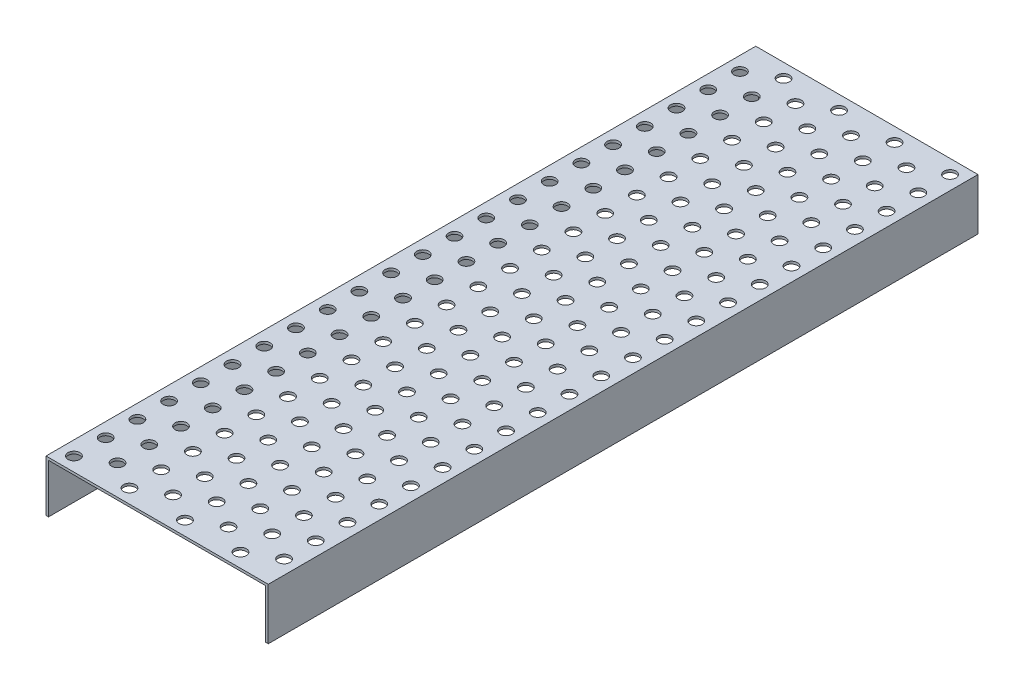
SolidWorks part; units mm, degrees
ref_plane "Alzado" through (0, 0, 0) normal (0, 0, 1) x (1, 0, 0)
ref_plane "Planta" through (0, 0, 0) normal (0, 1, 0) x (1, 0, 0)
ref_plane "Vista lateral" through (0, 0, 0) normal (1, 0, 0) x (0, 0, -1)
sketch "Croquis2" plane through (0, 0, 0) normal (0, 0, 1) x (1, 0, 0)
  line L0 (0, 0) -> (0, 41.275)
  line L1 (0, 41.275) -> (178, 41.275)
  line L2 (0, 0) -> (2, 0)
  line L3 (2, 0) -> (2, 39.275)
  line L4 (178, 41.275) -> (178, 0)
  line L5 (178, 0) -> (176, 0)
  line L6 (176, 0) -> (176, 39.275)
  line L7 (2, 39.275) -> (176, 39.275)
  dimension "D1" = 41.275
  dimension "D2" = 178
  dimension "D3" = 2
  dimension "D4" = 2
  dimension "D5" = 39.275
  dimension "D6" = 39.275
extrude "Saliente-Extruir1" add sketch "Croquis2" along normal blind 568.452
sketch "Croquis3" plane through (0, 41.275, 0) normal (0, 1, 0) x (1, 0, 0)
  circle A0 centre (11.2125, -23.876) radius 4.7625
  circle A1 centre (33.4375, -11.176) radius 4.7625
  circle A2 centre (55.6625, -23.876) radius 4.7625
  circle A3 centre (100.1125, -23.876) radius 4.7625
  circle A4 centre (144.5625, -23.876) radius 4.7625
  circle A5 centre (11.2125, -49.276) radius 4.7625
  circle A6 centre (55.6625, -49.276) radius 4.7625
  circle A7 centre (100.1125, -49.276) radius 4.7625
  circle A8 centre (144.5625, -49.276) radius 4.7625
  circle A9 centre (11.2125, -74.676) radius 4.7625
  circle A10 centre (55.6625, -74.676) radius 4.7625
  circle A11 centre (100.1125, -74.676) radius 4.7625
  circle A12 centre (144.5625, -74.676) radius 4.7625
  circle A13 centre (11.2125, -100.076) radius 4.7625
  circle A14 centre (55.6625, -100.076) radius 4.7625
  circle A15 centre (100.1125, -100.076) radius 4.7625
  circle A16 centre (144.5625, -100.076) radius 4.7625
  circle A17 centre (11.2125, -125.476) radius 4.7625
  circle A18 centre (55.6625, -125.476) radius 4.7625
  circle A19 centre (100.1125, -125.476) radius 4.7625
  circle A20 centre (144.5625, -125.476) radius 4.7625
  circle A21 centre (11.2125, -150.876) radius 4.7625
  circle A22 centre (55.6625, -150.876) radius 4.7625
  circle A23 centre (100.1125, -150.876) radius 4.7625
  circle A24 centre (144.5625, -150.876) radius 4.7625
  circle A25 centre (11.2125, -176.276) radius 4.7625
  circle A26 centre (55.6625, -176.276) radius 4.7625
  circle A27 centre (100.1125, -176.276) radius 4.7625
  circle A28 centre (144.5625, -176.276) radius 4.7625
  circle A29 centre (11.2125, -201.676) radius 4.7625
  circle A30 centre (55.6625, -201.676) radius 4.7625
  circle A31 centre (100.1125, -201.676) radius 4.7625
  circle A32 centre (144.5625, -201.676) radius 4.7625
  circle A33 centre (11.2125, -227.076) radius 4.7625
  circle A34 centre (55.6625, -227.076) radius 4.7625
  circle A35 centre (100.1125, -227.076) radius 4.7625
  circle A36 centre (144.5625, -227.076) radius 4.7625
  circle A37 centre (11.2125, -252.476) radius 4.7625
  circle A38 centre (55.6625, -252.476) radius 4.7625
  circle A39 centre (100.1125, -252.476) radius 4.7625
  circle A40 centre (144.5625, -252.476) radius 4.7625
  circle A41 centre (11.2125, -277.876) radius 4.7625
  circle A42 centre (55.6625, -277.876) radius 4.7625
  circle A43 centre (100.1125, -277.876) radius 4.7625
  circle A44 centre (144.5625, -277.876) radius 4.7625
  circle A45 centre (11.2125, -303.276) radius 4.7625
  circle A46 centre (55.6625, -303.276) radius 4.7625
  circle A47 centre (100.1125, -303.276) radius 4.7625
  circle A48 centre (144.5625, -303.276) radius 4.7625
  circle A49 centre (11.2125, -328.676) radius 4.7625
  circle A50 centre (55.6625, -328.676) radius 4.7625
  circle A51 centre (100.1125, -328.676) radius 4.7625
  circle A52 centre (144.5625, -328.676) radius 4.7625
  circle A53 centre (11.2125, -354.076) radius 4.7625
  circle A54 centre (55.6625, -354.076) radius 4.7625
  circle A55 centre (100.1125, -354.076) radius 4.7625
  circle A56 centre (144.5625, -354.076) radius 4.7625
  circle A57 centre (11.2125, -379.476) radius 4.7625
  circle A58 centre (55.6625, -379.476) radius 4.7625
  circle A59 centre (100.1125, -379.476) radius 4.7625
  circle A60 centre (144.5625, -379.476) radius 4.7625
  circle A61 centre (11.2125, -404.876) radius 4.7625
  circle A62 centre (55.6625, -404.876) radius 4.7625
  circle A63 centre (100.1125, -404.876) radius 4.7625
  circle A64 centre (144.5625, -404.876) radius 4.7625
  circle A65 centre (11.2125, -430.276) radius 4.7625
  circle A66 centre (55.6625, -430.276) radius 4.7625
  circle A67 centre (100.1125, -430.276) radius 4.7625
  circle A68 centre (144.5625, -430.276) radius 4.7625
  circle A69 centre (11.2125, -455.676) radius 4.7625
  circle A70 centre (55.6625, -455.676) radius 4.7625
  circle A71 centre (100.1125, -455.676) radius 4.7625
  circle A72 centre (144.5625, -455.676) radius 4.7625
  circle A73 centre (11.2125, -481.076) radius 4.7625
  circle A74 centre (55.6625, -481.076) radius 4.7625
  circle A75 centre (100.1125, -481.076) radius 4.7625
  circle A76 centre (144.5625, -481.076) radius 4.7625
  circle A77 centre (11.2125, -506.476) radius 4.7625
  circle A78 centre (55.6625, -506.476) radius 4.7625
  circle A79 centre (100.1125, -506.476) radius 4.7625
  circle A80 centre (144.5625, -506.476) radius 4.7625
  circle A81 centre (11.2125, -531.876) radius 4.7625
  circle A82 centre (55.6625, -531.876) radius 4.7625
  circle A83 centre (100.1125, -531.876) radius 4.7625
  circle A84 centre (144.5625, -531.876) radius 4.7625
  circle A85 centre (11.2125, -557.276) radius 4.7625
  circle A86 centre (55.6625, -557.276) radius 4.7625
  circle A87 centre (100.1125, -557.276) radius 4.7625
  circle A88 centre (144.5625, -557.276) radius 4.7625
  circle A89 centre (77.8875, -11.176) radius 4.7625
  circle A90 centre (122.3375, -11.176) radius 4.7625
  circle A91 centre (166.7875, -11.176) radius 4.7625
  circle A92 centre (33.4375, -36.576) radius 4.7625
  circle A93 centre (77.8875, -36.576) radius 4.7625
  circle A94 centre (122.3375, -36.576) radius 4.7625
  circle A95 centre (166.7875, -36.576) radius 4.7625
  circle A96 centre (33.4375, -61.976) radius 4.7625
  circle A97 centre (77.8875, -61.976) radius 4.7625
  circle A98 centre (122.3375, -61.976) radius 4.7625
  circle A99 centre (166.7875, -61.976) radius 4.7625
  circle A100 centre (33.4375, -87.376) radius 4.7625
  circle A101 centre (77.8875, -87.376) radius 4.7625
  circle A102 centre (122.3375, -87.376) radius 4.7625
  circle A103 centre (166.7875, -87.376) radius 4.7625
  circle A104 centre (33.4375, -112.776) radius 4.7625
  circle A105 centre (77.8875, -112.776) radius 4.7625
  circle A106 centre (122.3375, -112.776) radius 4.7625
  circle A107 centre (166.7875, -112.776) radius 4.7625
  circle A108 centre (33.4375, -138.176) radius 4.7625
  circle A109 centre (77.8875, -138.176) radius 4.7625
  circle A110 centre (122.3375, -138.176) radius 4.7625
  circle A111 centre (166.7875, -138.176) radius 4.7625
  circle A112 centre (33.4375, -163.576) radius 4.7625
  circle A113 centre (77.8875, -163.576) radius 4.7625
  circle A114 centre (122.3375, -163.576) radius 4.7625
  circle A115 centre (166.7875, -163.576) radius 4.7625
  circle A116 centre (33.4375, -188.976) radius 4.7625
  circle A117 centre (77.8875, -188.976) radius 4.7625
  circle A118 centre (122.3375, -188.976) radius 4.7625
  circle A119 centre (166.7875, -188.976) radius 4.7625
  circle A120 centre (33.4375, -214.376) radius 4.7625
  circle A121 centre (77.8875, -214.376) radius 4.7625
  circle A122 centre (122.3375, -214.376) radius 4.7625
  circle A123 centre (166.7875, -214.376) radius 4.7625
  circle A124 centre (33.4375, -239.776) radius 4.7625
  circle A125 centre (77.8875, -239.776) radius 4.7625
  circle A126 centre (122.3375, -239.776) radius 4.7625
  circle A127 centre (166.7875, -239.776) radius 4.7625
  circle A128 centre (33.4375, -265.176) radius 4.7625
  circle A129 centre (77.8875, -265.176) radius 4.7625
  circle A130 centre (122.3375, -265.176) radius 4.7625
  circle A131 centre (166.7875, -265.176) radius 4.7625
  circle A132 centre (33.4375, -290.576) radius 4.7625
  circle A133 centre (77.8875, -290.576) radius 4.7625
  circle A134 centre (122.3375, -290.576) radius 4.7625
  circle A135 centre (166.7875, -290.576) radius 4.7625
  circle A136 centre (33.4375, -315.976) radius 4.7625
  circle A137 centre (77.8875, -315.976) radius 4.7625
  circle A138 centre (122.3375, -315.976) radius 4.7625
  circle A139 centre (166.7875, -315.976) radius 4.7625
  circle A140 centre (33.4375, -341.376) radius 4.7625
  circle A141 centre (77.8875, -341.376) radius 4.7625
  circle A142 centre (122.3375, -341.376) radius 4.7625
  circle A143 centre (166.7875, -341.376) radius 4.7625
  circle A144 centre (33.4375, -366.776) radius 4.7625
  circle A145 centre (77.8875, -366.776) radius 4.7625
  circle A146 centre (122.3375, -366.776) radius 4.7625
  circle A147 centre (166.7875, -366.776) radius 4.7625
  circle A148 centre (33.4375, -392.176) radius 4.7625
  circle A149 centre (77.8875, -392.176) radius 4.7625
  circle A150 centre (122.3375, -392.176) radius 4.7625
  circle A151 centre (166.7875, -392.176) radius 4.7625
  circle A152 centre (33.4375, -417.576) radius 4.7625
  circle A153 centre (77.8875, -417.576) radius 4.7625
  circle A154 centre (122.3375, -417.576) radius 4.7625
  circle A155 centre (166.7875, -417.576) radius 4.7625
  circle A156 centre (33.4375, -442.976) radius 4.7625
  circle A157 centre (77.8875, -442.976) radius 4.7625
  circle A158 centre (122.3375, -442.976) radius 4.7625
  circle A159 centre (166.7875, -442.976) radius 4.7625
  circle A160 centre (33.4375, -468.376) radius 4.7625
  circle A161 centre (77.8875, -468.376) radius 4.7625
  circle A162 centre (122.3375, -468.376) radius 4.7625
  circle A163 centre (166.7875, -468.376) radius 4.7625
  circle A164 centre (33.4375, -493.776) radius 4.7625
  circle A165 centre (77.8875, -493.776) radius 4.7625
  circle A166 centre (122.3375, -493.776) radius 4.7625
  circle A167 centre (166.7875, -493.776) radius 4.7625
  circle A168 centre (33.4375, -519.176) radius 4.7625
  circle A169 centre (77.8875, -519.176) radius 4.7625
  circle A170 centre (122.3375, -519.176) radius 4.7625
  circle A171 centre (166.7875, -519.176) radius 4.7625
  circle A172 centre (33.4375, -544.576) radius 4.7625
  circle A173 centre (77.8875, -544.576) radius 4.7625
  circle A174 centre (122.3375, -544.576) radius 4.7625
  circle A175 centre (166.7875, -544.576) radius 4.7625
  dimension "D3" = 9.525
  dimension "D2" = 23.876
  dimension "D5" = 9.525
  dimension "D1" = 11.2125
  dimension "D4" = 22.225
  dimension "D10" = 11.176
  dimension "D6" = 22
  dimension "D7" = 22
  dimension "D8" = 11.176
  dimension "D9" = 22
extrude "Cortar-Extruir1" cut sketch "Croquis3" against normal up to next (2 mm away)
